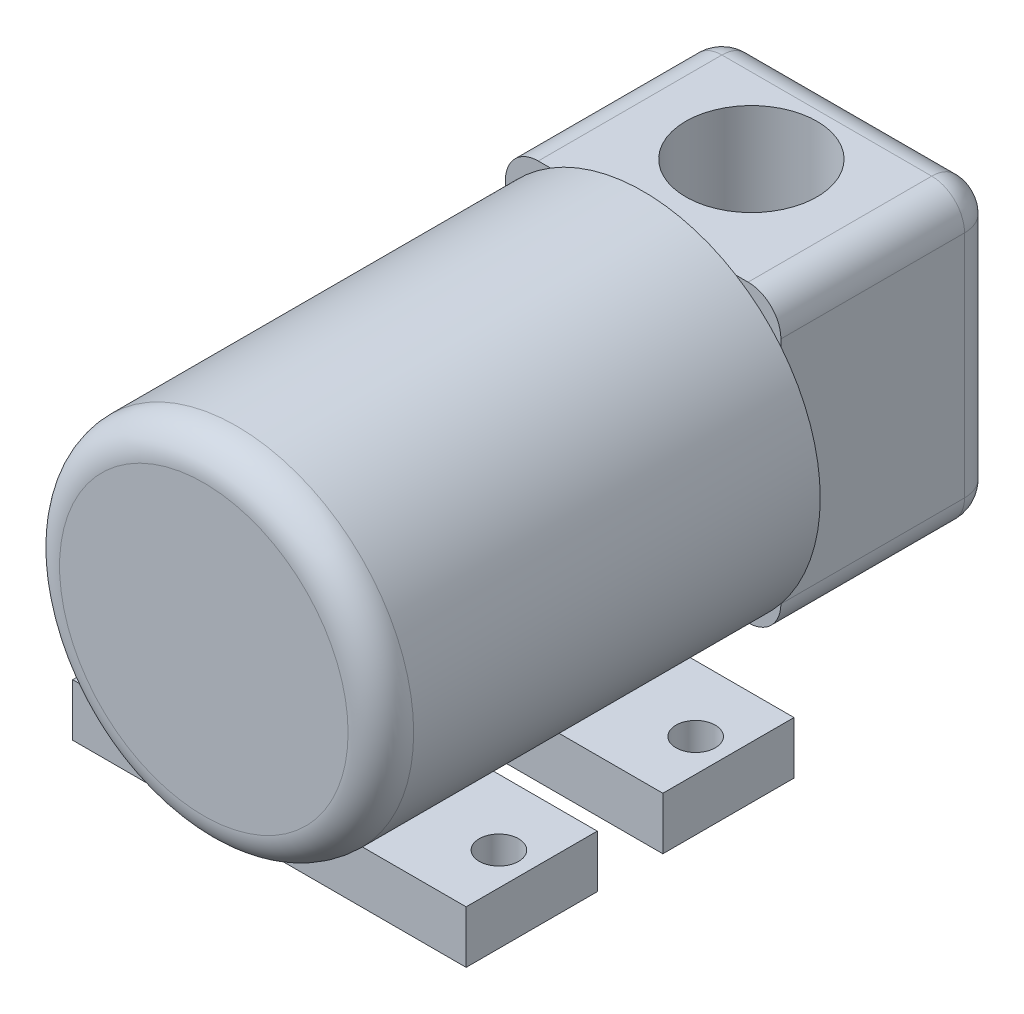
SolidWorks part; units mm, degrees
ref_plane "Front Plane" through (0, 0, 0) normal (0, 0, 1) x (1, 0, 0)
ref_plane "Top Plane" through (0, 0, 0) normal (0, 1, 0) x (1, 0, 0)
ref_plane "Right Plane" through (0, 0, 0) normal (1, 0, 0) x (0, 0, -1)
sketch "Sketch1" plane through (0, 0, 0) normal (0, 0, 1) x (1, 0, 0)
  circle A0 centre (0, 0) radius 27
  dimension "D1" = 54
extrude "Boss-Extrude1" add sketch "Sketch1" against normal blind 67
sketch "Sketch3" plane through (0, 0, -67) normal (0, 0, -1) x (-1, 0, 0)
  line L0 (0, -27) -> (0, 27) construction
  line L1 (-21, 23) -> (21, 23)
  line L2 (-21, 23) -> (-21, -22)
  line L3 (-21, -22) -> (21, -22)
  line L4 (21, 23) -> (21, -22)
  circle A0 centre (0, 0) radius 27 construction
  circle A1 centre (0, 0) radius 27 construction
  point P10 (0, -27)
  point P12 (0, -22)
  dimension "D1" = 45
  dimension "D2" = 42
  dimension "D3" = 5
extrude "Boss-Extrude2" add sketch "Sketch3" along normal blind 33
sketch "Sketch4" plane through (0, 23, 0) normal (0, 1, 0) x (1, 0, 0)
  line L0 (-21, 100) -> (21, 100) construction
  line L1 (-21, 100) -> (-21, 67) construction
  circle A0 centre (0, 83.5) radius 10
  point P4 (0, 100)
  point P7 (-21, 83.5)
  dimension "D1" = 20
extrude "Cut-Extrude1" cut sketch "Sketch4" against normal blind 84
fillet "Fillet2" radius 5 8 edges at (0, -22, -100) (-21, 0.5, -100) (21, 0.5, -100) (0, 23, -100) (21, 23, -83.5) (21, -22, -83.5) (-21, -22, -83.5) (-21, 23, -83.5)
fillet "Fillet3" radius 5 1 edges at (27, 0, 0)
ref_plane "Plane5" through (0, -32, 0) normal (0, -1, 0) x (-1, 0, 0)
ref_plane "Plane6" through (31, 0, 0) normal (1, 0, 0) x (0, 0, -1)
ref_plane "Plane7" through (31, 0, 0) normal (1, 0, 0) x (0, 0, -1)
sketch "Sketch8" plane through (1, -32, 0) normal (0, 1, 0) x (0, 0, -1)
  line L0 (0, 1) -> (101.9866, 1) construction
  line L1 (10, 31) -> (30, 31)
  line L2 (10, 31) -> (10, -29)
  line L3 (10, -29) -> (30, -29)
  line L4 (30, 31) -> (30, -29)
  line L5 (40, 31) -> (60, 31)
  line L6 (40, 31) -> (40, -29)
  line L7 (40, -29) -> (60, -29)
  line L8 (60, 31) -> (60, -29)
  line L9 (0, 23) -> (0, -21) construction
  dimension "D1" = 20
  dimension "D2" = 20
  dimension "D3" = 10
  dimension "D4" = 10
  dimension "D5" = 60
extrude "Boss-Extrude5" add sketch "Sketch8" along normal blind 8 contours L5 L8 L7 L6
hole_wizard "Ø6.0mm Dowel Hole1" positions "Sketch14" profile "Sketch13" hole size "Ø6.0" standard "ANSI Metric"
sketch "Sketch14" plane through (0, -24, 0) normal (0, 1, 0) x (1, 0, 0)
  line L0 (-30, 60) -> (-30, 40) construction
  line L1 (-12.3693, 60) -> (-30, 60) construction
  line L2 (-30, 30) -> (-30, 10) construction
  point P0 (-25, 50)
  point P2 (-25, 20)
  dimension "D1" = 5
  dimension "D2" = 10
  dimension "D3" = 5
  dimension "D4" = 10
sketch "Sketch13" plane through (-25, -24, -50) normal (1, 0, 0) x (0, 0, 1)
  line L0 (0, 0) -> (0, 8.001)
  line L1 (0, 8.001) -> (3, 8.001)
  line L2 (3, 8.001) -> (3, 0)
  line L5 (3, 0) -> (0, 0)
  line L11 (0, -6.35) -> (0, 107.95) construction
  dimension "Thru Hole Dia." = 6
  dimension "Thru Hole Depth" = 8.001
ref_plane "Plane8" through (0, 0, 0) normal (-1, 0, 0) x (0, 0, 1)
mirror "Mirror2" about plane through (0, 0, 0) normal (-1, 0, 0) of "Ø6.0mm Dowel Hole1"
